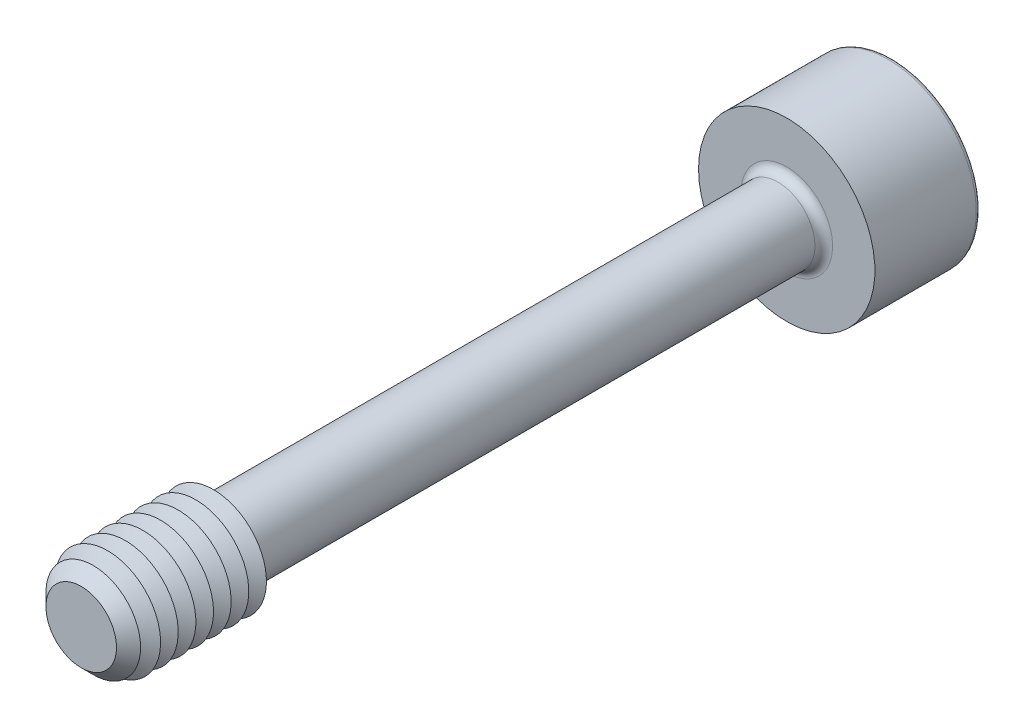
SolidWorks part; units mm, degrees
ref_plane "Front Plane" through (0, 0, 0) normal (0, 0, 1) x (1, 0, 0)
ref_plane "Top Plane" through (0, 0, 0) normal (0, 1, 0) x (1, 0, 0)
ref_plane "Right Plane" through (0, 0, 0) normal (1, 0, 0) x (0, 0, -1)
sketch "Sketch1" plane through (0, 0, 0) normal (0, 0, 1) x (1, 0, 0)
  circle A0 centre (0, 0) radius 2.1
  dimension "D1" = 4.2
extrude "Extrude1" add sketch "Sketch1" along normal mid plane 40
sketch "Sketch2" plane through (0, 0, 0) normal (1, 0, 0) x (0, 0, -1)
  line L0 (-20, 0) -> (-20, 3)
  line L1 (-20, 2.1) -> (-20, -2.1) construction
  line L2 (-20, 3) -> (-12.5, 3)
  line L3 (-12.5, 3) -> (-11.9804, 2.1)
  line L4 (20, 2.1) -> (-20, 2.1) construction
  line L5 (-11.9804, 2.1) -> (-11.9804, 0)
  line L6 (-11.9804, 0) -> (-20, 0)
  dimension "D1" = 3
  dimension "D2" = 120
  dimension "D3" = 7.5
revolve "Revolve1" add sketch "Sketch2" angle 360 about L6
chamfer "Chamfer1" distance 1 angle 45 1 edges at (0, 3, 20)
sketch "Sketch3" plane through (0, 0, -20) normal (0, 0, -1) x (-1, 0, 0)
  circle A0 centre (0, 0) radius 5
  dimension "D1" = 10
extrude "Extrude2" add sketch "Sketch3" along normal blind 6
sketch "Sketch4" plane through (-13.7, 0, -26) normal (0, 0, 1) x (1, 0, 0)
  line L2 (12.2566, -2.5) -> (15.1434, -2.5)
  line L3 (15.1434, -2.5) -> (16.5868, 0)
  line L4 (16.5868, 0) -> (15.1434, 2.5)
  line L6 (15.1434, 2.5) -> (12.2566, 2.5)
  line L7 (12.2566, 2.5) -> (10.8132, 0)
  line L8 (10.8132, 0) -> (12.2566, -2.5)
  circle A0 centre (13.7, 0) radius 2.5 construction
  dimension "D1" = 5
extrude "Extrude3" cut sketch "Sketch4" along normal blind 5
fillet "Fillet1" radius 0.5 1 edges at (-2.1, 0, -20)
fillet "Fillet2" radius 0.25 1 edges at (-5, 0, -26)
sketch "Sketch5" plane through (0, 0, 0) normal (1, 0, 0) x (0, 0, -1)
  line L0 (21, 0) -> (21, -2.5)
  line L1 (21, -2.5) -> (19.5566, 0)
  line L2 (19.5566, 0) -> (21, 0)
  dimension "D1" = 30
revolve "Cut-Revolve1" cut sketch "Sketch5" angle 360 about L2
sketch "Sketch6" plane through (0, 0, 0) normal (1, 0, 0) x (0, 0, -1)
  line L0 (1.332, 0) -> (-13.289, 0) construction
sketch "Sketch7" plane through (0, 0, 0) normal (1, 0, 0) x (0, 0, -1)
  line L0 (-12.5, 3) -> (-13, 2.134)
  line L1 (-13, 2.134) -> (-13.5, 3)
  line L2 (-12.5, 3) -> (-19, 3) construction
  line L3 (-13.5, 3) -> (-12.5, 3)
  dimension "D1" = 1
revolve "Cut-Revolve2" cut sketch "Sketch7" angle 360 about L0
pattern_linear "LPattern1" count 7 spacing 1 along (0, 0, 1) of "Cut-Revolve2"
